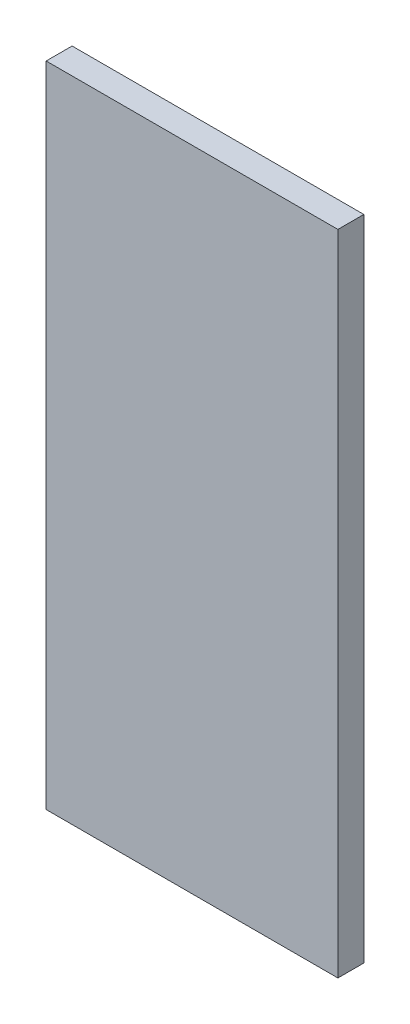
SolidWorks part; units mm, degrees
ref_plane "前视基准面" through (0, 0, 0) normal (0, 0, 1) x (1, 0, 0)
ref_plane "上视基准面" through (0, 0, 0) normal (0, 1, 0) x (1, 0, 0)
ref_plane "右视基准面" through (0, 0, 0) normal (1, 0, 0) x (0, 0, -1)
sketch "草图1" plane through (0, 0, 0) normal (0, 0, 1) x (1, 0, 0)
  line L1 (0, 0) -> (90, 0)
  line L2 (0, 0) -> (0, 200)
  line L3 (0, 200) -> (90, 200)
  line L4 (90, 0) -> (90, 200)
  dimension "D1" = 90
  dimension "D2" = 200
extrude "拉伸1" add sketch "草图1" along normal blind 8
